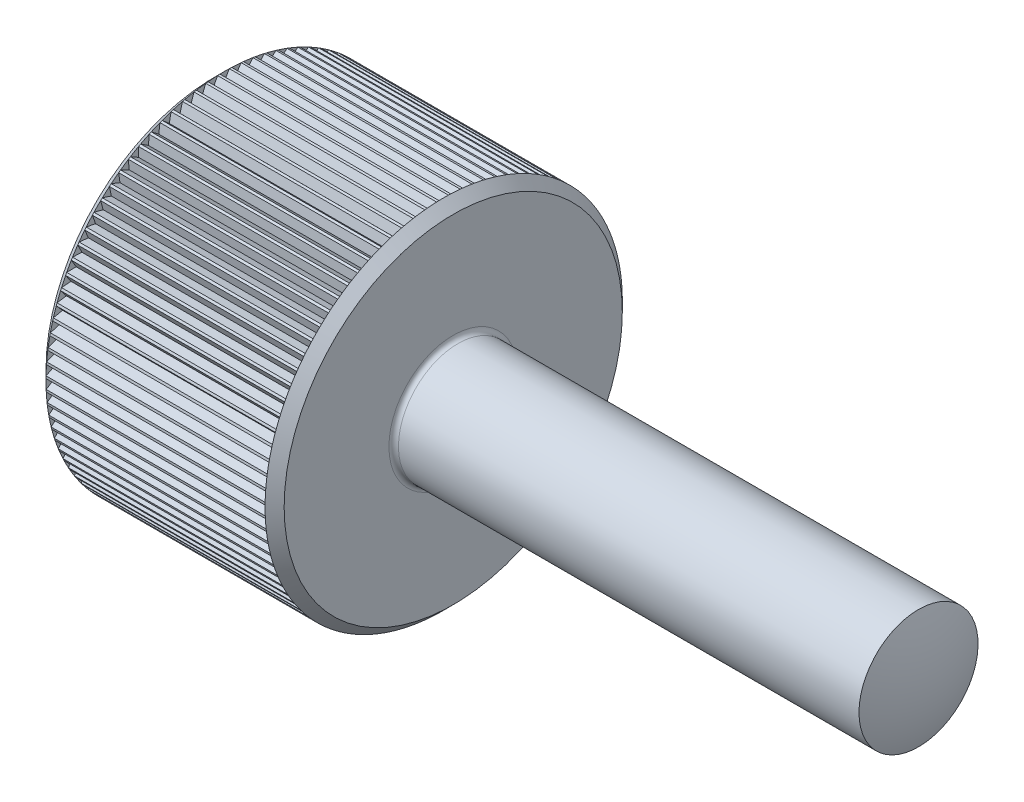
SolidWorks part; units mm, degrees
ref_plane "Front" through (0, 0, 0) normal (0, 0, 1) x (1, 0, 0)
ref_plane "Top" through (0, 0, 0) normal (0, 1, 0) x (1, 0, 0)
ref_plane "Right" through (0, 0, 0) normal (1, 0, 0) x (0, 0, -1)
sketch "Sketch1" plane through (0, 0, 0) normal (0, 0, 1) x (1, 0, 0)
  line L0 (0, 0) -> (0, 15)
  line L1 (0, 15) -> (20, 15)
  line L2 (20, 15) -> (20, 5)
  line L7 (20, 5) -> (59.0767, 5)
  line L8 (0, 0) -> (60, 0)
  line L9 (-48.2111, 0) -> (101.1311, 0) construction
  arc A0 (60, 0) -> (59.0767, 5) centre (46, 0) ccw
  dimension "re" = 14
  dimension "dk" = 30
  dimension "d" = 10
  dimension "k" = 20
  dimension "l" = 40
revolve "Base" add sketch "Sketch1" angle 360 about L9
chamfer "Chamfer1" distance 0.8 angle 45 2 edges at (0, 0, 15) (20, 0, 15)
ref_plane "Plane1" through (19.2, 0, 0) normal (1, 0, 0) x (0, 0, -1)
sketch "Sketch3" plane through (19.2, 0, 0) normal (1, 0, 0) x (0, 0, -1)
  line L1 (0, 14.3072) -> (0.6, 15.3464)
  line L2 (0.6, 15.3464) -> (-0.6, 15.3464)
  line L3 (-0.6, 15.3464) -> (0, 14.3072)
  circle A1 centre (0, 0) radius 15 construction
  circle A2 centre (0, 15) radius 0.3464 construction
  dimension "D1" = 1.2
extrude "Cut-Extrude1" cut sketch "Sketch3" against normal blind 18.4
pattern_circular "Circular-Pattern1" count 95 over 360 about axis through (0, 0, 0) along (1, 0, 0) of "Cut-Extrude1"
fillet "Fillet1" radius 0.4 1 edges at (20, 0, 5)
sketch "Sketch4" plane through (0, 0, 0) normal (0, 0, 1) x (1, 0, 0)
  line L0 (20.4, 6) -> (21.4, 6)
  line L1 (21.4, 6) -> (21.4, 5)
  line L2 (21.4, 5) -> (20.9, 4.134)
  line L3 (20.9, 4.134) -> (20.4, 5)
  line L4 (20.4, 5) -> (20.4, 6)
  line L5 (20.4, -5) -> (20.4, 5) construction
  line L6 (59.0767, 5) -> (20.4, 5) construction
  dimension "D1" = 1
revolve "Cut-Revolve10" [suppressed] cut sketch "Sketch4" angle 360 about axis through (-48.2111, 0, 0) along (1, 0, 0)
pattern_linear "LPattern10" [suppressed] count 33 along (1, 0, 0)
equation "\"D1@Circular-Pattern1\" =int (  \"dk@Sketch1\" * PI+1 ) "
equation "\"D1@ThreadCosmetic1\" = \"l@Sketch1\""
equation "\"D1@Plane1\" = \"c@Chamfer1\""
equation "\"D1@Cut-Extrude1\" = \"k@Sketch1\" - 2 * \"c@Chamfer1\""
equation "\"D1@Sketch4\" =  ( \"d@Sketch1\" - \"THD_MINOR@ThreadCosmetic1\" )  / 2"
equation "\"pitch@LPattern10\" = 1.2 * \"D1@Sketch4\""
equation "\"D1@LPattern10\" = (  \"D1@ThreadCosmetic1\" - \"r@Fillet1\" )  / \"pitch@LPattern10\""
equation "\"D1@Sketch3\" = \"c@Chamfer1\" * 1.5"
